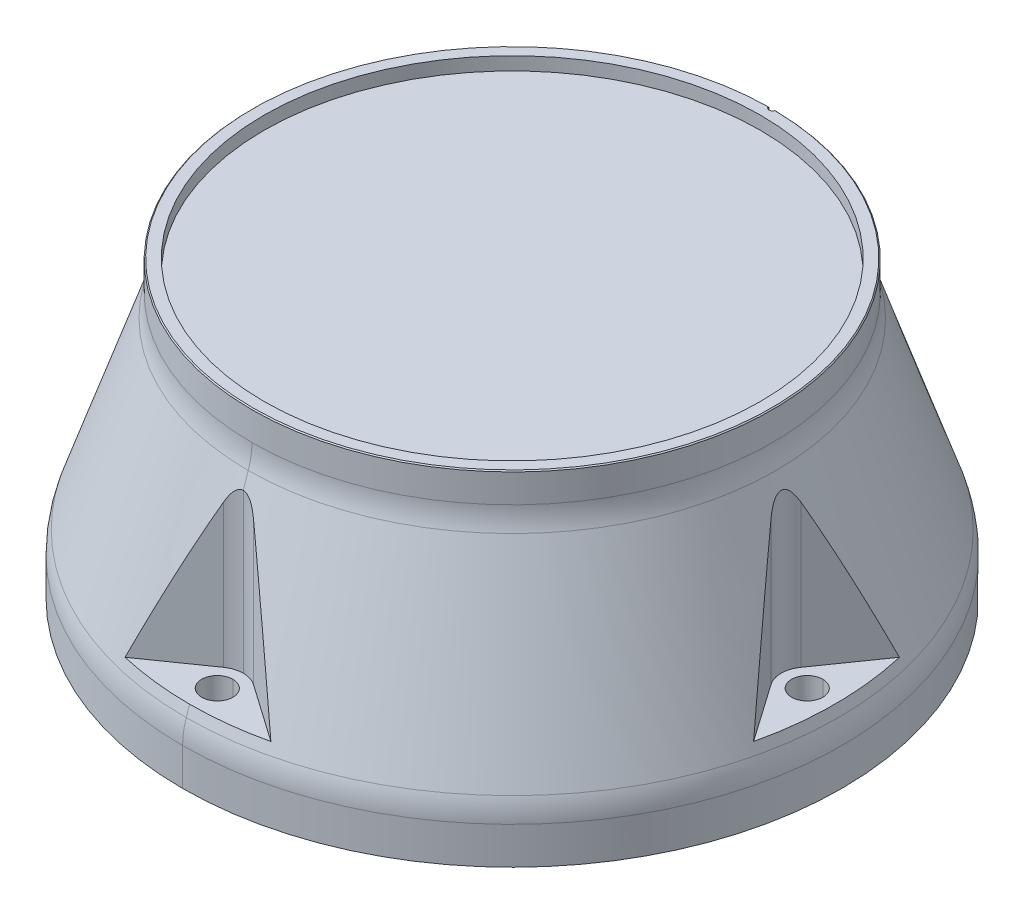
SolidWorks part; units mm, degrees
ref_plane "前视基准面" through (0, 0, 0) normal (0, 0, 1) x (1, 0, 0)
ref_plane "上视基准面" through (0, 0, 0) normal (0, 1, 0) x (1, 0, 0)
ref_plane "右视基准面" through (0, 0, 0) normal (1, 0, 0) x (0, 0, -1)
imported_body "8.0.00.8050005.STEP"
sketch "草图2" plane through (0, 85, 0) normal (0, 1, 0) x (1, 0, 0)
  circle A0 centre (0, 0) radius 182.5548
extrude "切除-拉伸1" cut sketch "草图2" against normal blind 0.2
other "删除面1"
sketch "草图3" plane through (0, 0, 0) normal (0, -1, 0) x (1, 0, 0)
  line L1 (975.9086, -466.2341) -> (-975.9086, -466.2341)
  line L2 (975.9086, -466.2341) -> (975.9086, 466.2341)
  line L3 (975.9086, 466.2341) -> (-975.9086, 466.2341)
  line L4 (-975.9086, -466.2341) -> (-975.9086, 466.2341)
  line L5 (975.9086, -466.2341) -> (-975.9086, 466.2341) construction
  line L6 (975.9086, 466.2341) -> (-975.9086, -466.2341) construction
  point P0 (0, 0)
extrude "凸台-拉伸1" [suppressed] add sketch "草图3" along normal blind 10
sketch "草图4" plane through (0, 81, 0) normal (0, 1, 0) x (1, 0, 0)
  circle A0 centre (0, 0) radius 71.5
extrude "凸台-拉伸2" add sketch "草图4" against normal up to surface (36 mm away)
